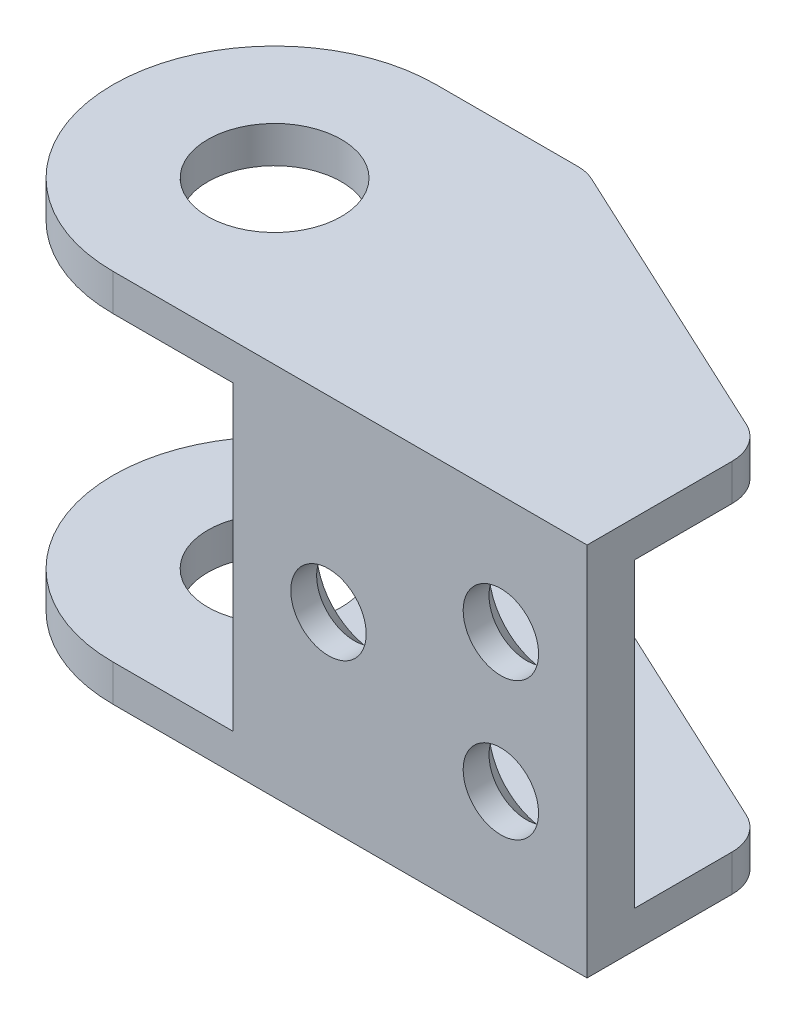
SolidWorks part; units mm, degrees
ref_plane "Aufriss" through (0, 0, 0) normal (0, 0, 1) x (1, 0, 0)
ref_plane "Grundriss" through (0, 0, 0) normal (0, 1, 0) x (1, 0, 0)
ref_plane "Seitenriss" through (0, 0, 0) normal (1, 0, 0) x (0, 0, -1)
imported_body "2018_03_08__10-15-02-011_2-1-solid1"
sketch "Skizze1" plane through (0, 0, 63.5) normal (0, 0, 1) x (1, 0, 0)
  line L0 (-487.5, 1.2) -> (-487.5, 8.8) construction
  line L1 (-503, 13.7) -> (-487.5, 13.7)
  line L2 (-503, 13.7) -> (-503, -3.7)
  line L3 (-503, -3.7) -> (-487.5, -3.7)
  line L4 (-487.5, 13.7) -> (-487.5, -3.7)
  point P5 (-503, -3.7)
extrude "Schnitt-Linear austragen1" cut sketch "Skizze1" against normal through all
sketch "Skizze2" plane through (0, 0, 61.3) normal (0, 0, -1) x (-1, 0, 0)
  line L1 (503, 10) -> (519.44, 10)
  line L2 (503, 10) -> (503, 0)
  line L3 (503, 0) -> (519.44, 0)
  line L4 (519.44, 10) -> (519.44, 0)
extrude "Aufsatz-Linear austragen1" add sketch "Skizze2" against normal up to surface (2.2 mm away)
sketch "Skizze6" plane through (0, 0, 48.5) normal (0, 0, -1) x (-1, 0, 0)
  line L0 (503, 13.7) -> (525, 13.7) construction
  line L1 (519.44, 13.7) -> (503, 13.7)
  line L2 (519.44, 13.7) -> (519.44, -3.7)
  line L3 (519.44, -3.7) -> (503, -3.7)
  line L4 (503, 13.7) -> (503, -3.7)
  line L5 (519.44, 12) -> (519.44, 10) construction
  point P7 (518.9625, 13.7)
extrude "Schnitt-Linear austragen2" cut sketch "Skizze6" against normal up to surface (12.8 mm away)
sketch "Skizze8" plane through (-519.44, 0, 0) normal (1, 0, 0) x (0, 0, -1)
  line L0 (-61.3, -2) -> (-61.3, -3.7) construction
  line L1 (-61.3, -3.7) -> (-48.5, -3.7) construction
  line L2 (-48.5, -3.7) -> (-48.5, -2) construction
  line L3 (-48.5, -2) -> (-61.3, -2) construction
  line L4 (-48.5, 12) -> (-48.5, 13.7) construction
  line L5 (-48.5, 13.7) -> (-61.3, 13.7) construction
  line L6 (-61.3, 13.7) -> (-61.3, 12) construction
  line L7 (-61.3, 12) -> (-48.5, 12) construction
  line L8 (-61.3, -2) -> (-61.3, -3.7)
  line L9 (-61.3, -3.7) -> (-48.5, -3.7)
  line L10 (-48.5, -3.7) -> (-48.5, -2)
  line L11 (-48.5, -2) -> (-61.3, -2)
  line L12 (-48.5, 12) -> (-48.5, 13.7)
  line L13 (-48.5, 13.7) -> (-61.3, 13.7)
  line L14 (-61.3, 13.7) -> (-61.3, 12)
  line L15 (-61.3, 12) -> (-48.5, 12)
extrude "Aufsatz-Linear austragen2" add sketch "Skizze8" along normal up to surface (16.44 mm away)
sketch "Skizze9" plane through (0, -3.7, 0) normal (0, -1, 0) x (1, 0, 0)
  line L0 (-503, 48.5) -> (-503, 55.4946)
  line L1 (-503, 48.5) -> (-503, 63.5) construction
  line L2 (-503, 55.4946) -> (-518, 48.5)
  line L3 (-525, 48.5) -> (-503, 48.5) construction
  line L4 (-518, 48.5) -> (-503, 48.5)
  dimension "D1" = 15
  dimension "D2" = 25
extrude "Schnitt-Linear austragen3" cut sketch "Skizze9" against normal through all
hole_wizard "Formsenkung für M3 Senkschraube mit Innensechskant1" positions "Skizze3" profile "Skizze5" countersink size "M3" standard "DIN"
sketch "Skizze3" plane through (0, 0, 61.3) normal (0, 0, -1) x (-1, 0, 0)
  line L0 (507, 8.2) -> (507, 1.8) construction
  line L2 (507, 5) -> (515, 5) construction
  line L4 (507, 5) -> (503, 5) construction
  line L5 (503, -2) -> (503, 12) construction
  point P0 (507, 8.2)
  point P2 (507, 1.8)
  point P4 (515, 5)
  dimension "D1" = 4
  dimension "D2" = 8
  dimension "D3" = 6.4
sketch "Skizze5" plane through (-507, 8.2, 61.3) normal (1, 0, 0) x (0, 1, 0)
  line L0 (0, 0) -> (0, 2.2001)
  line L1 (0, 2.2001) -> (1.75, 2.2001)
  line L2 (1.75, 2.2001) -> (1.75, 1)
  line L3 (1.75, 1) -> (2.75, 0)
  line L5 (2.75, 0) -> (0, 0)
  line L6 (-1.75, 1) -> (-2.75, 0) construction
  line L11 (0, -6.35) -> (0, 107.95) construction
  dimension "Bohrerdurchmesser" = 3.5
  dimension "Bohrungstiefe" = 2.2001
  dimension "Senkdurchmesser (Oben)" = 5.5
  dimension "Senkwinkel (Oben)" = 90
fillet "Verrundung1" radius 2 4 edges at (-518, -2.85, 48.5) (-518, 12.85, 48.5) (-503, 12.85, 55.4946) (-503, -2.85, 55.4946)
